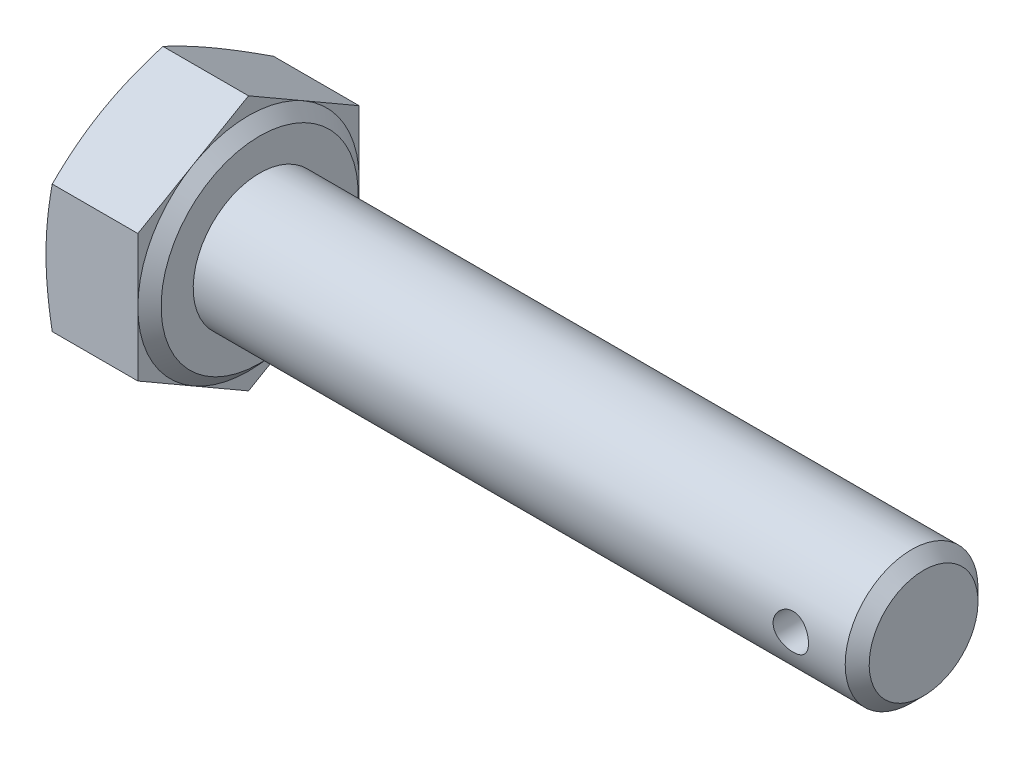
SolidWorks part; units mm, degrees
ref_plane "Front" through (0, 0, 0) normal (0, 0, 1) x (1, 0, 0)
ref_plane "Top" through (0, 0, 0) normal (0, 1, 0) x (1, 0, 0)
ref_plane "Right" through (0, 0, 0) normal (1, 0, 0) x (0, 0, -1)
sketch "Sketch-BaseHead" plane through (0, 0, 0) normal (1, 0, 0) x (0, 0, -1)
  line L1 (0, -5.7735) -> (5, -2.8868)
  line L2 (5, -2.8868) -> (5, 2.8868)
  line L3 (5, 2.8868) -> (0, 5.7735)
  line L4 (0, 5.7735) -> (-5, 2.8868)
  line L5 (-5, 2.8868) -> (-5, -2.8868)
  line L6 (-5, -2.8868) -> (0, -5.7735)
  circle A0 centre (0, 0) radius 5 construction
  dimension "s" = 10
extrude "BaseHead" add sketch "Sketch-BaseHead" along normal blind 4.15
sketch "Sketch4" plane through (-0.2646, -5.9169, 0) normal (0, 0, 1) x (0, 1, 0)
  line L0 (5.9169, 3.7369) -> (5.9169, -10.4477) construction
  line L2 (11.6904, -0.2646) -> (10.9169, -0.2646)
  line L4 (10.9169, -0.2646) -> (11.6904, -0.5462)
  line L6 (11.6904, -0.5462) -> (11.6904, -0.2646)
  dimension "D1" = 20
  dimension "D2" = 10
revolve "HeadChamfer" cut sketch "Sketch4" angle 360 about L0
sketch "Sketch1" plane through (0, 0, 0) normal (0, 1, 0) x (1, 0, 0)
  line L0 (4.15, 0) -> (4.65, 0)
  line L1 (4.65, 0) -> (4.65, 4.45)
  line L2 (4.65, 4.45) -> (4.15, 5)
  line L3 (4.15, 5) -> (4.15, 0)
  line L6 (-4.0016, 0) -> (10.1831, 0) construction
  dimension "D1" = 5
  dimension "D2" = 4.45
  dimension "D3" = 0.5
revolve "Revolve1" add sketch "Sketch1" angle 360 about axis through (-4.0016, 0, 0) along (1, 0, 0)
ref_plane "Plane2" through (16.65, 0, 0) normal (1, 0, 0) x (0, 0, -1)
sketch "Sketch3" plane through (4.65, 0, 0) normal (1, 0, 0) x (0, 0, -1)
  circle A0 centre (0, 0) radius 3
  dimension "d" = 6
extrude "BaseBody" add sketch "Sketch3" along normal blind 30
chamfer "Chamfer1" distance 0.5415 angle 45 1 edges at (34.65, 3, 0)
fillet "HeadFillet" [suppressed] radius 0.25
sketch "Sketch5" plane through (0, 0, 0) normal (0, 0, 1) x (1, 0, 0)
  line L2 (4.65, -4.45) -> (4.65, 4.45) construction
  line L3 (34.1085, 0) -> (4.65, 0) construction
  circle A0 centre (31.65, 0) radius 0.8
  dimension "d1" = 1.6
  dimension "lh" = 27
extrude "Hole" cut sketch "Sketch5" against normal through all and the other way through all
sketch "Sketch6" plane through (0, 0, 0) normal (0, 0, 1) x (1, 0, 0)
  line L0 (33.566, 3.2) -> (34.1075, 3.2)
  line L1 (34.1075, 3.2) -> (34.1075, 3)
  line L2 (34.1075, 3) -> (33.8367, 2.531)
  line L3 (33.566, 3) -> (33.8367, 2.531)
  line L4 (33.566, 3.2) -> (33.566, 3)
  line L5 (27.8988, 0) -> (0, 0) construction
  line L6 (33.566, 3) -> (34.1075, 3) construction
  line L7 (33.8367, 3) -> (33.8367, 2.531) construction
  line L8 (34.1085, 3) -> (4.65, 3) construction
  point P5 (33.8367, 3.2)
  dimension "D1" = 0.2
  dimension "D2" = 0.5415
  dimension "D3" = 0.001
revolve "Cut-Revolve10" [suppressed] cut sketch "Sketch6" angle 360 about L5
pattern_linear "LPattern10" [suppressed] count 28 spacing 0.6498
equation "\"D1@Sketch1\" = \"s@Sketch-BaseHead\" / 2"
equation "\"D2@Sketch4\" = \"s@Sketch-BaseHead\""
equation "\"D1@Chamfer1\" = (  \"d@Sketch3\"  -\"D2@ThreadCosmetic1\" ) / 2 "
equation "\"b@ThreadCosmetic1\" = \"l@BaseBody\" - \"lg@Plane2\""
equation "\"D2@Sketch6\" = (  \"d@Sketch3\" - \"D2@ThreadCosmetic1\" )  / 2"
equation "\"D3@LPattern10\" =\"D2@Sketch6\" * 1.2"
equation "\"D1@LPattern10\" = \"b@ThreadCosmetic1\" / \"D3@LPattern10\""
equation "\"D3@Sketch6\" = 0.001"
